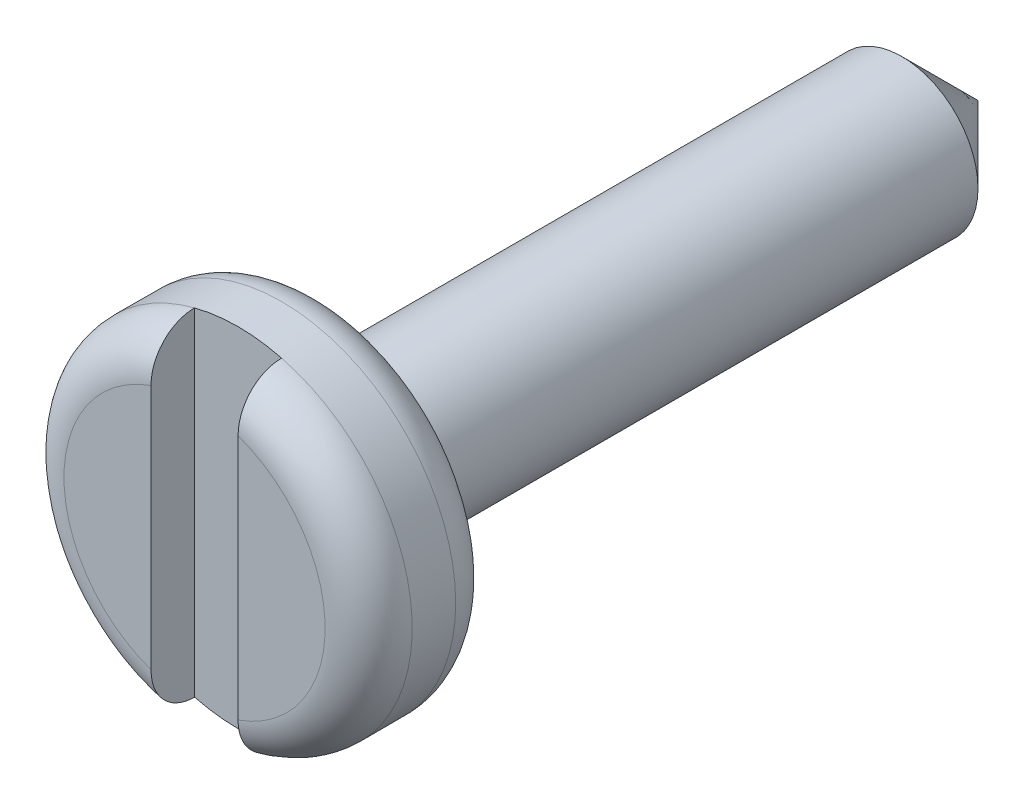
SolidWorks part; units mm, degrees
ref_plane "Plane1" through (0, 0, 0) normal (0, 0, 1) x (1, 0, 0)
ref_plane "Plane2" through (0, 0, 0) normal (0, 1, 0) x (1, 0, 0)
ref_plane "Plane3" through (0, 0, 0) normal (1, 0, 0) x (0, 0, -1)
sketch "Sketch1" plane through (0, 0, 0) normal (0, 0, 1) x (1, 0, 0)
  circle A0 centre (0, 0) radius 1.75
  dimension "D1" = 3.5
extrude "Base-Extrude" add sketch "Sketch1" against normal blind 15
sketch "Sketch2" plane through (0, 0, 0) normal (0, 0, -1) x (-1, 0, 0)
  circle A0 centre (0, 0) radius 4
  dimension "D1" = 8
extrude "Boss-Extrude1" add sketch "Sketch2" against normal blind 3
fillet "Fillet3" radius 1 2 edges at (-4, 0, 3) (-4, 0, 0)
sketch "Sketch5" plane through (0, 0, 3) normal (0, 0, 1) x (1, 0, 0)
  line L0 (0, -50) -> (0, 50) construction
  line L1 (-1, 4.9994) -> (1, 4.9994)
  line L2 (-1, 4.9994) -> (-1, -5.0006)
  line L3 (-1, -5.0006) -> (1, -5.0006)
  line L4 (1, 4.9994) -> (1, -5.0006)
  dimension "D1" = 2
  dimension "D2" = 1
  dimension "D3" = 10
  dimension "D4" = 5.0006
extrude "Cut-Extrude2" cut sketch "Sketch5" against normal blind 1
chamfer "Chamfer1" distance 1.75 angle 45 1 edges at (1.75, 0, -15)
